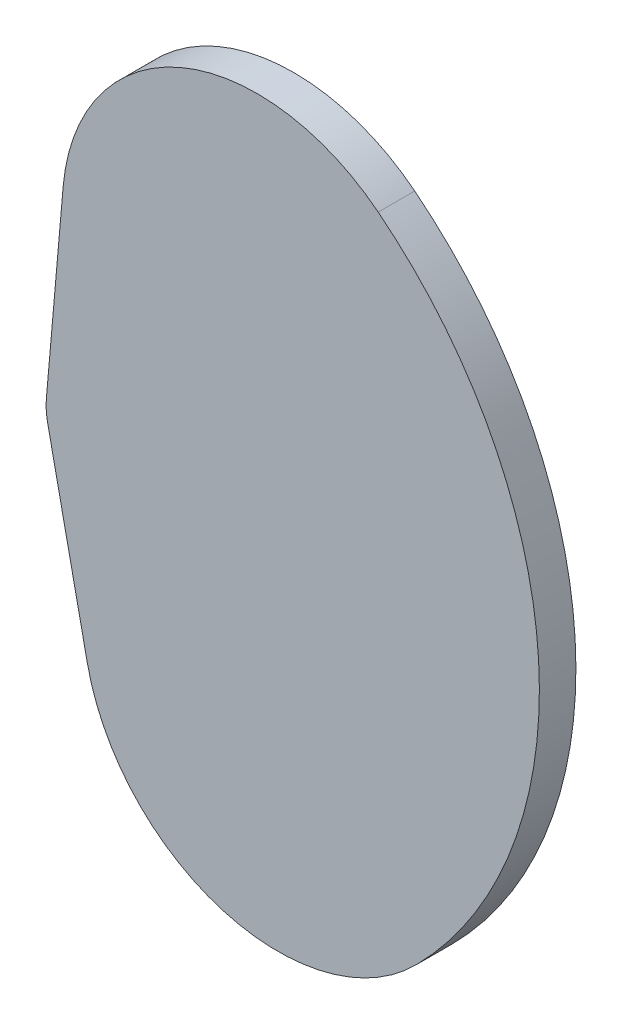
SolidWorks part; units mm, degrees
ref_plane "Front Plane" through (0, 0, 0) normal (0, 0, 1) x (1, 0, 0)
ref_plane "Top Plane" through (0, 0, 0) normal (0, 1, 0) x (1, 0, 0)
ref_plane "Right Plane" through (0, 0, 0) normal (1, 0, 0) x (0, 0, -1)
sketch "Sketch1" plane through (0, 0, 0) normal (0, 0, 1) x (1, 0, 0)
  line L1 (-99.5736, -19.8544) -> (-120.3194, 78.4223)
  line L4 (-112.1931, 188.8668) -> (-120.9473, 88.8065)
  arc A2 (-75.251, -67.3134) -> (72.0844, -70.3026) centre (-0.1644, 1.1305) ccw
  arc A3 (-99.5736, -19.8544) -> (-75.251, -67.3134) centre (-0.1644, 1.1305) ccw
  arc A4 (72.0844, -70.3026) -> (52.1364, 259.6291) centre (-85.725, 85.725) ccw
  arc A6 (-120.9473, 88.8065) -> (-120.3194, 78.4223) centre (-85.725, 85.725) ccw
  arc A10 (52.1364, 259.6291) -> (-93.7656, 238.9105) centre (-10.9797, 180.0118) ccw
  arc A11 (-93.7656, 238.9105) -> (-112.1931, 188.8668) centre (-10.9797, 180.0118) ccw
extrude "Extrude1" add sketch "Sketch1" along normal blind 19.05
